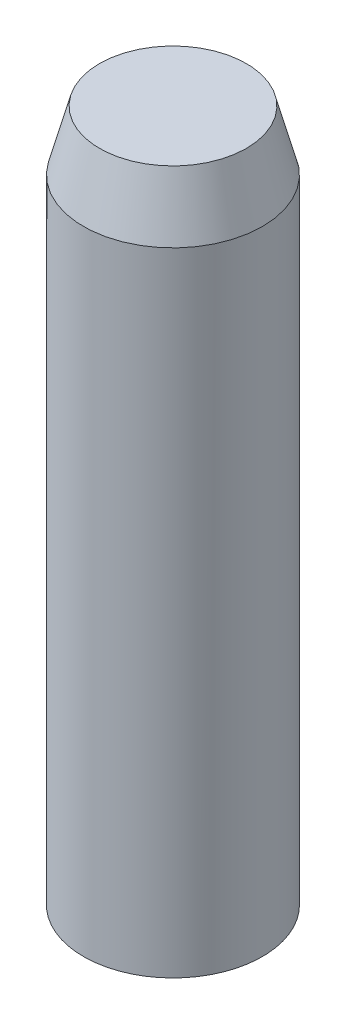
SolidWorks part; units mm, degrees
ref_plane "Face" through (0, 0, 0) normal (0, 0, 1) x (1, 0, 0)
ref_plane "Dessus" through (0, 0, 0) normal (0, 1, 0) x (1, 0, 0)
ref_plane "Cote" through (0, 0, 0) normal (1, 0, 0) x (0, 0, -1)
sketch "Esquisse3" plane through (0, 0, 0) normal (0, 0, 1) x (1, 0, 0)
  line L1 (0, 20) -> (0, 0)
  line L2 (2, 18.6667) -> (1.6427, 20)
  line L3 (2, 18.6667) -> (2, 0.5359)
  line L4 (0, 20) -> (0, 0) construction
  line L5 (0, 20) -> (1.6427, 20)
  arc A0 (2, 0.5359) -> (0, 0) centre (0, 4) cw
  dimension "R" = 4
  dimension "D1" = 15
  dimension "D" = 4
  dimension "L" = 20
  dimension "A" = 1.3333
revolve "Base-Révolution" add sketch "Esquisse3" angle 360 about L1
